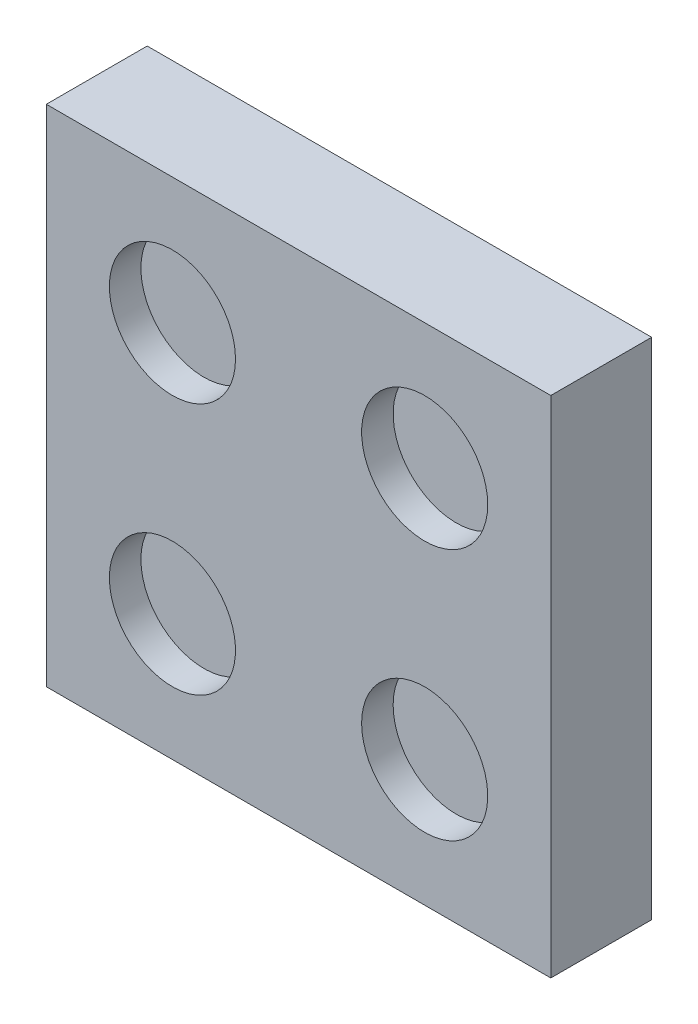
SolidWorks part; units mm, degrees
ref_plane "Front Plane" through (0, 0, 0) normal (0, 0, 1) x (1, 0, 0)
ref_plane "Top Plane" through (0, 0, 0) normal (0, 1, 0) x (1, 0, 0)
ref_plane "Right Plane" through (0, 0, 0) normal (1, 0, 0) x (0, 0, -1)
sketch "Sketch1" plane through (0, 0, 0) normal (0, 0, 1) x (1, 0, 0)
  line L1 (0, 0) -> (50.8, 0)
  line L2 (0, 0) -> (0, 50.8)
  line L3 (0, 50.8) -> (50.8, 50.8)
  line L4 (50.8, 0) -> (50.8, 50.8)
  dimension "D1" = 50.8
  dimension "D2" = 50.8
extrude "Boss-Extrude1" add sketch "Sketch1" along normal blind 10.16
sketch "Sketch3" plane through (0, 0, 10.16) normal (0, 0, 1) x (1, 0, 0)
  line L0 (0, 50.8) -> (0, 0) construction
  line L1 (50.8, 50.8) -> (0, 50.8) construction
  line L2 (0, 0) -> (50.8, 0) construction
  line L3 (25.4, 50.8) -> (25.4, 0)
  line L5 (12.7, 152.4) -> (12.7, 0)
  line L6 (38.1, 50.8) -> (38.1, 0)
  line L7 (50.8, 50.8) -> (50.8, 0)
  line L8 (63.5, 50.8) -> (63.5, 0)
  line L9 (76.2, 50.8) -> (76.2, 0)
  line L10 (88.9, 50.8) -> (88.9, 0)
  line L11 (0, 12.7) -> (50.8, 12.7)
  line L12 (50.8, 0) -> (50.8, 50.8) construction
  line L13 (0, 25.4) -> (50.8, 25.4)
  line L14 (0, 38.1) -> (50.8, 38.1)
  line L15 (0, 50.8) -> (50.8, 50.8)
  line L16 (0, 63.5) -> (50.8, 63.5)
  line L17 (0, 63.6141) -> (50.8, 63.6141)
  line L18 (0, 76.2) -> (50.8, 76.2)
  line L19 (0, 88.9) -> (50.8, 88.9)
  line L20 (0, 101.6) -> (50.8, 101.6)
  line L21 (0, 114.3) -> (50.8, 114.3)
  line L22 (0, 127) -> (50.8, 127)
  line L23 (0, 139.7) -> (50.8, 139.7)
  circle A0 centre (12.7, 139.7) radius 6.35
  circle A2 centre (38.1, 139.7) radius 6.35
  circle A4 centre (63.5, 139.7) radius 2.54
  circle A6 centre (88.9, 139.7) radius 2.54
  circle A7 centre (88.9, 114.3) radius 2.54
  circle A8 centre (63.5, 114.3) radius 2.54
  circle A9 centre (38.1, 114.3) radius 6.35
  circle A10 centre (12.7, 114.3) radius 6.35
  circle A11 centre (88.9, 88.9) radius 2.54
  circle A12 centre (63.5, 88.9) radius 2.54
  circle A13 centre (38.1, 88.9) radius 6.35
  circle A14 centre (12.7, 88.9) radius 6.35
  circle A15 centre (88.9, 63.5) radius 2.54
  circle A16 centre (63.5, 63.5) radius 2.54
  circle A17 centre (38.1, 63.5) radius 6.35
  circle A18 centre (12.7, 63.5) radius 6.35
  circle A19 centre (88.9, 38.1) radius 2.54
  circle A20 centre (63.5, 38.1) radius 2.54
  circle A21 centre (38.1, 38.1) radius 6.35
  circle A22 centre (12.7, 38.1) radius 6.35
  circle A23 centre (88.9, 12.7) radius 2.54
  circle A24 centre (63.5, 12.7) radius 2.54
  circle A25 centre (38.1, 12.7) radius 6.35
  circle A26 centre (12.7, 12.7) radius 6.35
  dimension "D1" = 12.7
  dimension "D2" = 12.7
  dimension "D3" = 12.7
  dimension "D4" = 12.7
  dimension "D5" = 12.7
  dimension "D6" = 12.7
  dimension "D7" = 12.7
  dimension "D8" = 12.7
  dimension "D9" = 12.7
  dimension "D10" = 12.7
  dimension "D11" = 12.7
  dimension "D12" = 12.7
  dimension "D13" = 12.7
  dimension "D14" = 12.7
  dimension "D15" = 12.7
  dimension "D16" = 12.7
  dimension "D17" = 12.7
  dimension "D18" = 12.7
extrude "Cut-Extrude2" cut sketch "Sketch3" against normal blind 3.175 contours A0 | A2 | A4 | A6 | A7 | A8 | A9 | A10 | A14 | A13 | A12 | A11 | A18 | A17 | A16 | A15 | A22 | A21 | A20 | A19 | A26 | A25 | A24 | A23
sketch "Sketch6" plane through (0, 0, 0) normal (0, 0, -1) x (-1, 0, 0)
  circle A0 centre (-25.4, 25.4) radius 12.7
extrude "Cut-Extrude3" cut sketch "Sketch6" against normal blind 5.08
sketch "Sketch8" plane through (0, 0, 0) normal (0, 0, -1) x (-1, 0, 0)
  line L0 (0, 0) -> (-50.8, 0) construction
  line L1 (-24.0221, 0) -> (-26.5621, 0)
  line L2 (-24.0221, 0) -> (-24.0221, 12.7533)
  line L3 (-24.0221, 12.7533) -> (-26.5621, 12.7533)
  line L4 (-26.5621, 0) -> (-26.5621, 12.7533)
  circle A0 centre (-25.4, 25.4) radius 12.7 construction
  dimension "D1" = 2.54
extrude "Cut-Extrude6" cut sketch "Sketch8" against normal blind 5.08
